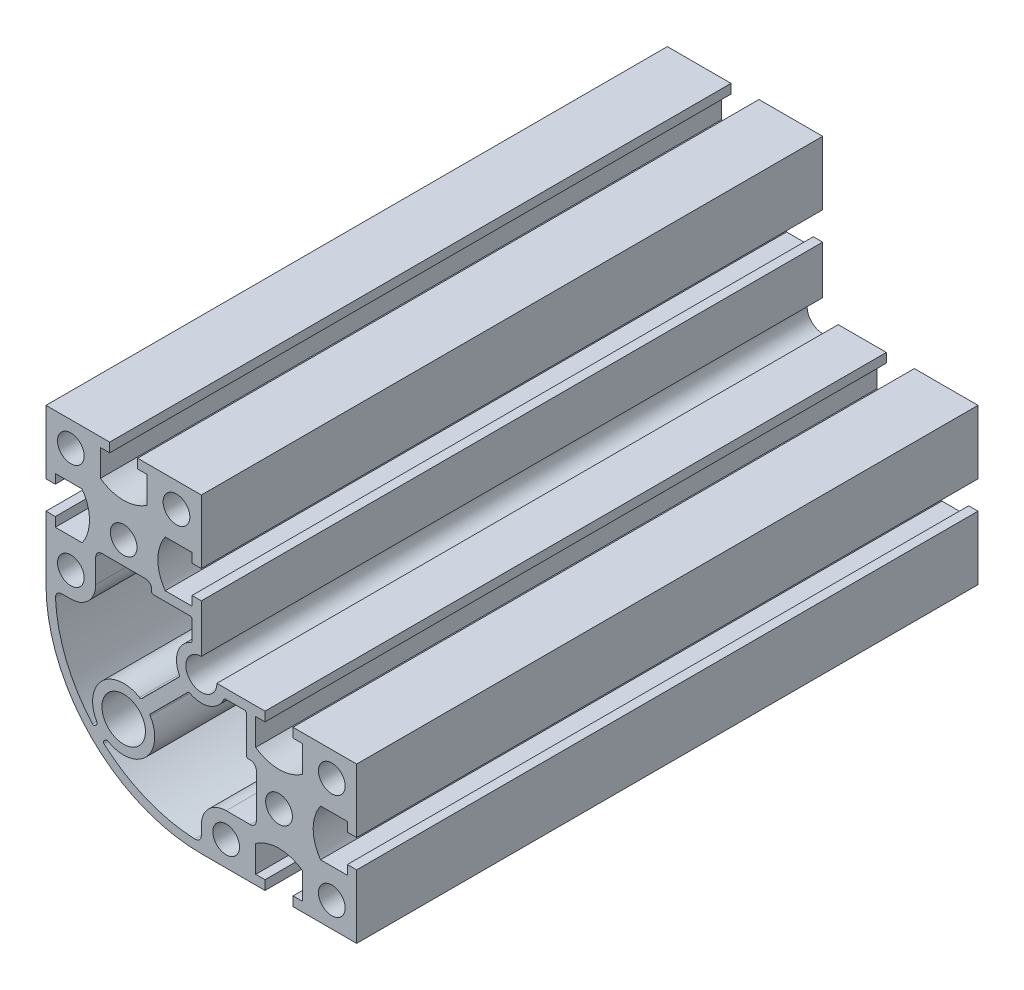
SolidWorks part; units mm, degrees
ref_plane "前基準面" through (0, 0, 0) normal (0, 0, 1) x (1, 0, 0)
ref_plane "上基準面" through (0, 0, 0) normal (0, 1, 0) x (1, 0, 0)
ref_plane "右基準面" through (0, 0, 0) normal (1, 0, 0) x (0, 0, -1)
sketch "草圖1" plane through (0, 0, 0) normal (0, 0, 1) x (1, 0, 0)
  line L0 (0, 50) -> (0, 39.75)
  line L1 (25, 0) -> (35.25, 0)
  line L2 (50, 0) -> (50, 10.25)
  line L3 (50, 25) -> (39.75, 25)
  line L4 (25, 35.25) -> (25, 27.5)
  line L5 (25, 50) -> (14.75, 50)
  line L6 (37.5, 0) -> (37.5, 25) construction
  line L7 (25, 37.5) -> (0, 37.5) construction
  line L8 (39.75, 25) -> (39.75, 23.5)
  line L9 (39.75, 23.5) -> (41.25, 23.5)
  line L10 (41.25, 23.5) -> (41.25, 19.1908)
  line L11 (12.5, 50) -> (12.5, 37.5) construction
  line L12 (50, 14.75) -> (48.5, 14.75)
  line L13 (50, 10.25) -> (48.5, 10.25)
  line L14 (33.75, 23.5) -> (33.75, 19.1908)
  line L15 (35.25, 23.5) -> (33.75, 23.5)
  line L16 (35.25, 25) -> (35.25, 23.5)
  line L17 (50, 12.5) -> (37.5, 12.5) construction
  line L18 (35.25, 25) -> (27.5, 25)
  line L19 (48.5, 10.25) -> (48.5, 8.75)
  line L20 (48.5, 8.75) -> (44.1908, 8.75)
  line L21 (48.5, 16.25) -> (44.1908, 16.25)
  line L22 (23.5, 35.25) -> (23.5, 33.75)
  line L23 (23.5, 33.75) -> (19.1908, 33.75)
  line L24 (23.5, 41.25) -> (19.1908, 41.25)
  line L25 (23.5, 39.75) -> (23.5, 41.25)
  line L26 (25, 39.75) -> (23.5, 39.75)
  line L27 (25, 50) -> (25, 39.75)
  line L28 (25, 35.25) -> (23.5, 35.25)
  line L29 (26.5, 35.25) -> (26.5, 33.75)
  line L30 (26.5, 33.75) -> (30.8092, 33.75)
  line L31 (26.5, 41.25) -> (30.8092, 41.25)
  line L32 (26.5, 39.75) -> (26.5, 41.25)
  line L33 (25, 39.75) -> (26.5, 39.75)
  line L34 (25, 50) -> (25, 39.75)
  line L35 (25, 35.25) -> (26.5, 35.25)
  line L36 (48.5, 14.75) -> (48.5, 16.25)
  line L37 (39.75, 0) -> (39.75, 1.5)
  line L38 (35.25, 0) -> (35.25, 1.5)
  line L39 (35.25, 1.5) -> (33.75, 1.5)
  line L40 (33.75, 1.5) -> (33.75, 5.8092)
  line L41 (41.25, 1.5) -> (41.25, 5.8092)
  line L42 (39.75, 1.5) -> (41.25, 1.5)
  line L44 (50, 14.75) -> (50, 25)
  line L45 (39.75, 0) -> (50, 0)
  line L47 (14.75, 48.5) -> (16.25, 48.5)
  line L48 (16.25, 48.5) -> (16.25, 44.1908)
  line L49 (8.75, 48.5) -> (8.75, 44.1908)
  line L50 (10.25, 48.5) -> (8.75, 48.5)
  line L51 (10.25, 50) -> (10.25, 48.5)
  line L52 (14.75, 50) -> (14.75, 48.5)
  line L53 (1.5, 39.75) -> (1.5, 41.25)
  line L54 (1.5, 41.25) -> (5.8092, 41.25)
  line L55 (1.5, 33.75) -> (5.8092, 33.75)
  line L56 (1.5, 35.25) -> (1.5, 33.75)
  line L57 (0, 35.25) -> (1.5, 35.25)
  line L58 (0, 39.75) -> (1.5, 39.75)
  line L59 (10.25, 50) -> (0, 50)
  line L60 (0, 35.25) -> (0, 25)
  arc A0 (0, 25) -> (25, 0) centre (25, 25) ccw
  arc A1 (25, 27.5) -> (27.5, 25) centre (25, 25) ccw
  arc A2 (33.75, 19.1908) -> (41.25, 19.1908) centre (37.5, 24.5) ccw
  arc A3 (44.1908, 16.25) -> (44.1908, 8.75) centre (49.5, 12.5) ccw
  arc A4 (19.1908, 33.75) -> (19.1908, 41.25) centre (24.5, 37.5) cw
  arc A5 (30.8092, 33.75) -> (30.8092, 41.25) centre (25.5, 37.5) ccw
  arc A6 (41.25, 5.8092) -> (33.75, 5.8092) centre (37.5, 0.5) ccw
  circle A7 centre (46, 21) radius 2.15
  circle A8 centre (46, 4) radius 2.15
  circle A9 centre (29, 4) radius 2.15
  circle A10 centre (21, 46) radius 2.15
  arc A11 (16.25, 44.1908) -> (8.75, 44.1908) centre (12.5, 49.5) cw
  circle A12 centre (4, 46) radius 2.15
  circle A13 centre (4, 29) radius 2.15
  arc A14 (5.8092, 41.25) -> (5.8092, 33.75) centre (0.5, 37.5) cw
  circle A15 centre (37.5, 12.5) radius 2.15
  circle A16 centre (12.5, 37.5) radius 2.15
  point P5 (0, 0)
  point P37 (25, 25)
  dimension "D1" = 50
  dimension "D3" = 25
  dimension "D2" = 50
  dimension "D9" = 25
  dimension "D11" = 2
  dimension "D12" = 6.5
  dimension "D5" = 4.5
  dimension "D7" = 6.5
  dimension "D15" = 4.5
  dimension "D16" = 0.5
  dimension "D20" = 17
  dimension "D14" = 12.5
  dimension "D4" = 5
  dimension "D17" = 7.5
  dimension "D19" = 8.5
  dimension "D21" = 8.5
  dimension "D22" = 17
  dimension "D23" = 4.3
  dimension "D6" = 7.5
  dimension "D8" = 0.5
  dimension "D13" = 25
  dimension "D10" = 1.5
extrude "填料-伸長1" add sketch "草圖1" along normal mid plane 100
sketch "草圖2" plane through (0, 0, 50) normal (0, 0, 1) x (1, 0, 0)
  line L0 (8, 29) -> (8, 32.85)
  line L1 (16, 33.85) -> (9, 33.85)
  line L2 (12.5, 37.5) -> (12.5, 28.4877) construction
  line L3 (17, 32.55) -> (17, 32.85)
  line L4 (25, 25) -> (7.3223, 7.3223) construction
  line L5 (37.5, 12.5) -> (28.4877, 12.5) construction
  line L6 (28.9051, 23.5) -> (31.95, 23.5)
  line L7 (32.25, 23.2) -> (32.25, 17.3)
  line L8 (32.55, 17) -> (32.85, 17)
  line L9 (33.85, 16) -> (33.85, 9)
  line L10 (25, 4) -> (25, 2.5222)
  line L11 (29, 8) -> (32.85, 8)
  line L12 (33.75, 19.1908) -> (33.75, 23.5) construction
  line L16 (21.3946, 22.8088) -> (15.4261, 16.8403)
  line L17 (22.8088, 21.3946) -> (16.8403, 15.4261)
  line L18 (25.7071, 24.2929) -> (8.0294, 6.6152) construction
  line L19 (24.2929, 25.7071) -> (6.6152, 8.0294) construction
  line L20 (8.1597, 9.5739) -> (7.9138, 9.328)
  line L21 (9.5739, 8.1597) -> (9.328, 7.9138)
  line L51 (32.25, 17) -> (32.25, 23.5)
  line L54 (23.2, 32.25) -> (17.3, 32.25)
  line L56 (23.5, 27.5) -> (23.5, 35.25)
  line L57 (23.5, 28.9051) -> (23.5, 31.95)
  line L58 (4, 25) -> (2.5222, 25)
  line L59 (35.25, 23.5) -> (27.5, 23.5)
  line L60 (32.25, 23.5) -> (28.7081, 23.5)
  circle A0 centre (4, 29) radius 2.15 construction
  arc A1 (9, 33.85) -> (8, 32.85) centre (9, 32.85) ccw
  arc A2 (1.5232, 23.9556) -> (2.5222, 25) centre (2.5222, 24) cw
  arc A3 (16, 33.85) -> (17, 32.85) centre (16, 32.85) cw
  arc A4 (0, 25) -> (25, 0) centre (25, 25) ccw construction
  arc A5 (33.85, 16) -> (32.85, 17) centre (32.85, 16) ccw
  arc A6 (33.85, 9) -> (32.85, 8) centre (32.85, 9) cw
  arc A7 (25, 4) -> (29, 8) centre (29, 4) cw
  arc A8 (23.9556, 1.5232) -> (25, 2.5222) centre (24, 2.5222) ccw
  arc A9 (9.3402, 7.478) -> (23.9556, 1.5232) centre (25, 25) ccw
  arc A10 (1.5, 25) -> (25, 1.5) centre (25, 25) ccw
  arc A11 (1.5232, 23.9556) -> (7.478, 9.3402) centre (25, 25) ccw
  arc A12 (9.328, 7.9138) -> (9.3402, 7.478) centre (9.5401, 7.7017) ccw
  arc A13 (9.9397, 8.2053) -> (16.7947, 15.0603) centre (12.5, 12.5) ccw
  circle A14 centre (12.5, 12.5) radius 3.5
  arc A16 (25, 29) -> (29, 25) centre (25, 25) ccw
  arc A17 (23.3256, 28.6327) -> (21.4488, 23.159) centre (25, 25) ccw
  arc A18 (9.9397, 8.2053) -> (9.5739, 8.1597) centre (9.7861, 7.9476) ccw
  arc A19 (15.0603, 16.7947) -> (8.2053, 9.9397) centre (12.5, 12.5) ccw
  arc A20 (23.159, 21.4488) -> (28.6327, 23.3256) centre (25, 25) ccw
  arc A21 (32.55, 17) -> (32.25, 17.3) centre (32.55, 17.3) cw
  arc A22 (32.25, 23.2) -> (31.95, 23.5) centre (31.95, 23.2) ccw
  arc A23 (4, 25) -> (8, 29) centre (4, 29) ccw
  arc A24 (28.9051, 23.5) -> (28.6327, 23.3256) centre (28.9051, 23.2) ccw
  arc A25 (23.3256, 28.6327) -> (23.5, 28.9051) centre (23.2, 28.9051) ccw
  arc A26 (23.5, 31.95) -> (23.2, 32.25) centre (23.2, 31.95) ccw
  arc A27 (17.3, 32.25) -> (17, 32.55) centre (17.3, 32.55) cw
  arc A28 (7.478, 9.3402) -> (7.9138, 9.328) centre (7.7017, 9.5401) ccw
  arc A29 (8.1597, 9.5739) -> (8.2053, 9.9397) centre (7.9476, 9.7861) ccw
  arc A30 (15.0603, 16.7947) -> (15.4261, 16.8403) centre (15.2139, 17.0524) ccw
  arc A31 (21.3946, 22.8088) -> (21.4488, 23.159) centre (21.1825, 23.021) ccw
  arc A32 (22.8088, 21.3946) -> (23.159, 21.4488) centre (23.021, 21.1825) cw
  arc A33 (16.8403, 15.4261) -> (16.7947, 15.0603) centre (17.0524, 15.2139) ccw
  point P35 (12.5, 33.85)
  point P49 (33.85, 12.5)
  point P56 (9.1051, 7.6909)
  point P71 (9.743, 8.3288)
  point P86 (23.5, 28.7081)
  point P89 (23.5, 32.25)
  point P92 (17, 32.25)
  point P97 (8.3288, 9.743)
  dimension "D5" = 1
  dimension "D11" = 1
  dimension "D7" = 5
  dimension "D8" = 0.3
  dimension "D6" = 7
  dimension "D14" = 0.3
  dimension "D15" = 0.3
  dimension "D4" = 3.65
  dimension "D2" = 1.5
  dimension "D1" = 1.5
  dimension "D3" = 1.5
  dimension "D9" = 1.5
  dimension "D10" = 1.5
  dimension "D12" = 1
  dimension "D13" = 1
extrude "除料-伸長1" cut sketch "草圖2" against normal through all
